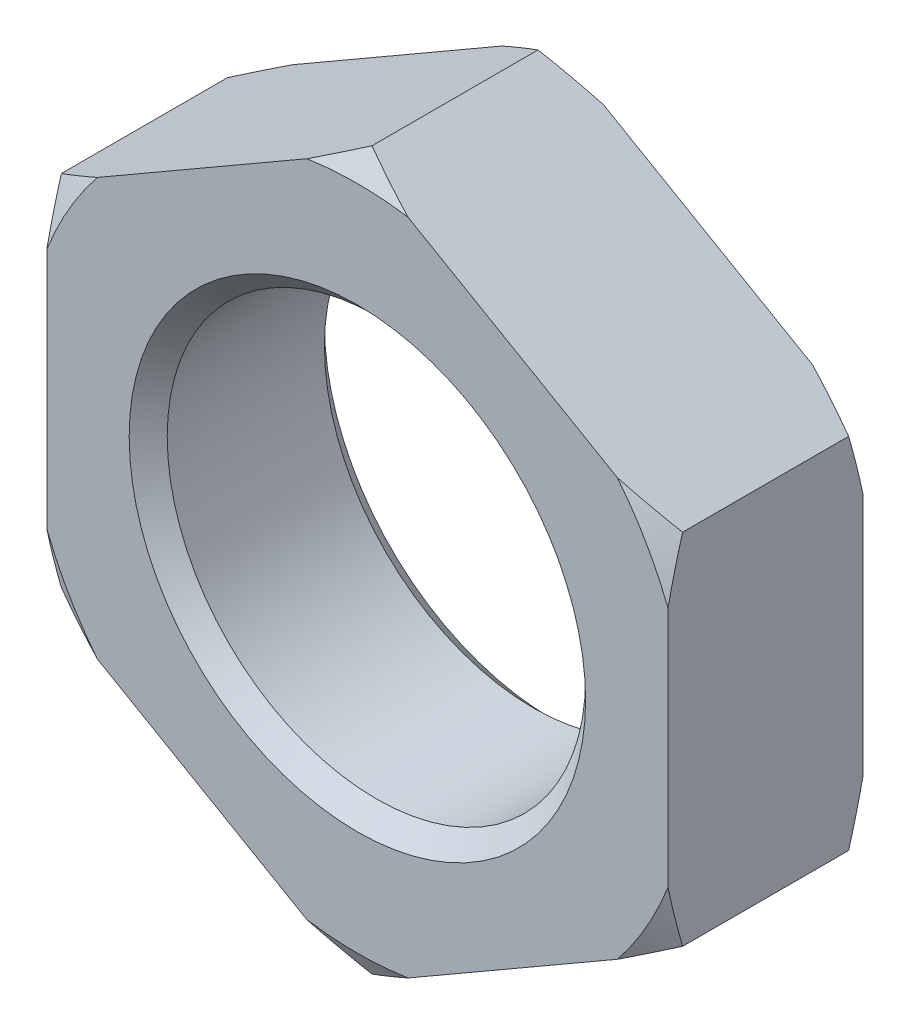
SolidWorks part; units mm, degrees
ref_plane "Front Plane" through (0, 0, 0) normal (0, 0, 1) x (1, 0, 0)
ref_plane "Top Plane" through (0, 0, 0) normal (0, 1, 0) x (1, 0, 0)
ref_plane "Right Plane" through (0, 0, 0) normal (1, 0, 0) x (0, 0, -1)
sketch "Sketch1" plane through (0, 0, 0) normal (0, 0, 1) x (1, 0, 0)
  line L1 (0, 28.2902) -> (-24.5, 14.1451)
  line L2 (-24.5, 14.1451) -> (-24.5, -14.1451)
  line L3 (-24.5, -14.1451) -> (0, -28.2902)
  line L4 (0, -28.2902) -> (24.5, -14.1451)
  line L5 (24.5, -14.1451) -> (24.5, 14.1451)
  line L6 (24.5, 14.1451) -> (0, 28.2902)
  circle A0 centre (0, 0) radius 24.5 construction
  circle A1 centre (0, 0) radius 16.5
  dimension "D2" = 33
  dimension "D1" = 49
extrude "Boss-Extrude1" add sketch "Sketch1" along normal mid plane 15.4
sketch "Sketch2" plane through (0, 0, 0) normal (1, 0, 0) x (0, 0, -1)
  line L0 (7.477, 0) -> (-8.5759, 0) construction
sketch "Sketch3" plane through (0, 0, 0) normal (1, 0, 0) x (0, 0, -1)
  line L0 (-7.7, 28.2902) -> (-7.7, 26.2902)
  line L1 (-7.7, 14.1451) -> (-7.7, 28.2902) construction
  line L2 (-7.7, 26.2902) -> (-6.5453, 28.2902)
  line L3 (-7.7, 28.2902) -> (7.7, 28.2902) construction
  line L4 (-6.5453, 28.2902) -> (-7.7, 28.2902)
  dimension "D1" = 2
  dimension "D2" = 30
revolve "Cut-Revolve1" cut sketch "Sketch3" angle 360 about L0
mirror "Mirror1" about plane through (0, 0, 0) normal (0, 0, 1) of "Cut-Revolve1"
chamfer "Chamfer1" distance 1.5 angle 45 2 edges at (16.5, 0, -7.7) (16.5, 0, 7.7)
